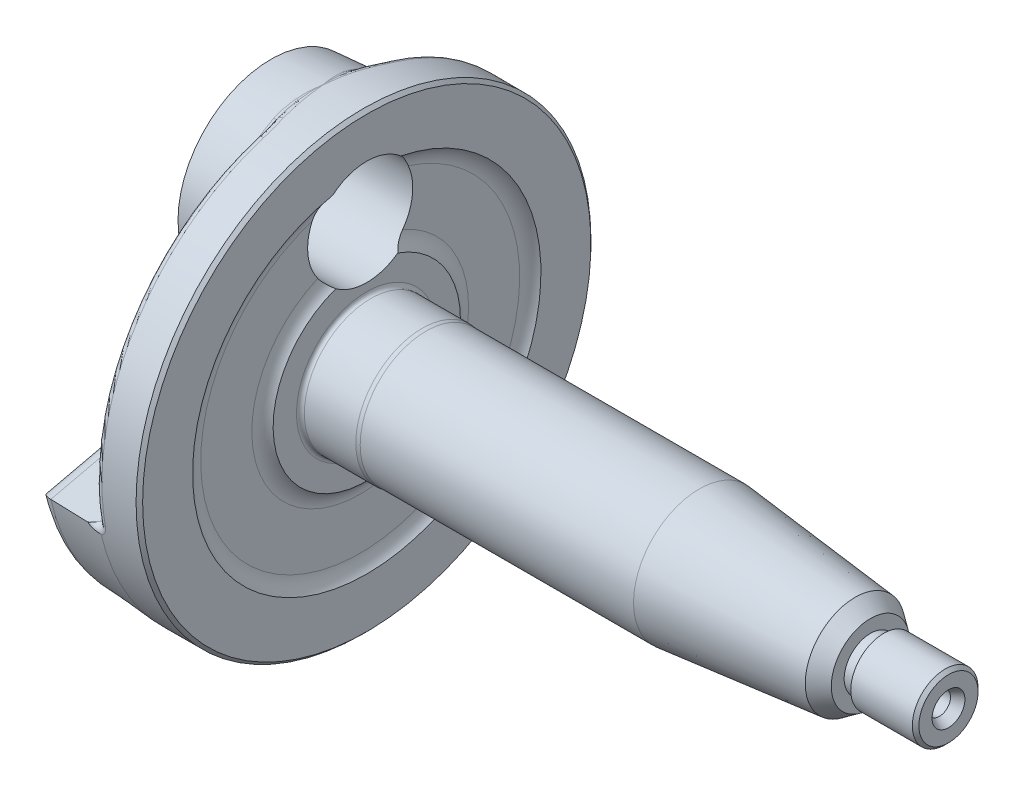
SolidWorks part; units mm, degrees
ref_plane "Plan de face" through (0, 0, 0) normal (0, 0, 1) x (1, 0, 0)
ref_plane "Plan de dessus" through (0, 0, 0) normal (0, 1, 0) x (1, 0, 0)
ref_plane "Plan de droite" through (0, 0, 0) normal (1, 0, 0) x (0, 0, -1)
sketch "Esquisse1" plane through (0, 0, 0) normal (0, 0, 1) x (1, 0, 0)
  line L0 (0, 0) -> (105.7, 0) construction
  line L1 (10.5, 34.6) -> (0, 33.8658)
  line L2 (10.5, 34.6) -> (17.2, 34.6)
  line L3 (17.2, 34.6) -> (17.2, 10.1)
  line L4 (67.7816, 10) -> (26.2, 10)
  line L5 (67.7816, 10) -> (91.5, 7.5908)
  line L6 (91.5, 7.5908) -> (95.2, 5)
  line L7 (95.2, 5) -> (105.7, 5)
  line L8 (105.7, 5) -> (105.7, 0)
  line L9 (0, 0) -> (105.7, 0)
  line L10 (0, 33.8658) -> (0, 0)
  line L11 (26.2, 10) -> (25.6329, 10.1)
  line L12 (25.6329, 10.1) -> (17.2, 10.1)
  line L13 (105.7, 0) -> (145.9071, 0) construction
  dimension "D1" = 69.2
  dimension "D2" = 9
  dimension "D3" = 10
  dimension "D4" = 35
  dimension "D5" = 88.5
  dimension "D6" = 74.3
  dimension "D7" = 10.5
  dimension "D8" = 6.7
  dimension "D9" = 5.8
  dimension "D10" = 4
  dimension "D11" = 17.2
  dimension "D12" = 10
  dimension "D13" = 20
  dimension "D14" = 20.2
revolve "Révolution1" add sketch "Esquisse1" angle 360 about L0
sketch "Esquisse2" plane through (0, 0, 0) normal (-1, 0, 0) x (0, 0, 1)
  line L0 (0, 0) -> (-49.8629, 0) construction
  line L1 (-46.6363, 10.7668) -> (-6.8206, 1.5747)
  line L2 (6.8206, -1.5747) -> (41.2588, -9.5253)
  line L3 (41.2588, -9.5253) -> (41.2588, 38.0793)
  line L4 (41.2588, 38.0793) -> (-46.6363, 38.0793)
  line L5 (-46.6363, 38.0793) -> (-46.6363, 10.7668)
  arc A0 (-6.8206, 1.5747) -> (6.8206, -1.5747) centre (0, 0) ccw
  dimension "D1" = 14
  dimension "D2" = 13
extrude "Extrusion1" cut sketch "Esquisse2" against normal blind 10.5 draft 4
sketch "Esquisse3" plane through (10.5, 0, 0) normal (-1, 0, 0) x (0, 0, 1)
  line L0 (0, 0) -> (0, 26.2707) construction
  line L2 (-10, -10.595) -> (10, -10.595)
  line L3 (-10, -10.595) -> (-10, 23.8355)
  line L4 (-10, 23.8355) -> (10, 23.8355)
  line L5 (10, -10.595) -> (10, 23.8355)
  dimension "D1" = 10
  dimension "D2" = 10
extrude "Extrusion2" add sketch "Esquisse3" along normal blind 4.65 draft 4
sketch "Esquisse4" plane through (10.5, 0, 0) normal (-1, 0, 0) x (0, 0, 1)
  circle A0 centre (0, 19.9) radius 14.7
  circle A1 centre (0, 0) radius 34.6 construction
  dimension "D1" = 19.9
extrude "Extrusion3" add sketch "Esquisse4" along normal blind 7.87 draft 4
sketch "Esquisse5" plane through (2.63, 0, 0) normal (-1, 0, 0) x (0, 0, 1)
  circle A0 centre (0, 19.9) radius 8
  circle A1 centre (0, 19.9) radius 14.1497 construction
  dimension "D1" = 16
extrude "Extrusion4" cut sketch "Esquisse5" against normal through all
hole_wizard "Dégagement M31" positions "Esquisse3D1" profile "Esquisse6" hole size "M3" standard "ISO"
sketch3d "Esquisse3D1"
  line L0 (105.7, 0, 0) -> (95.2, 0, 0) construction
  line L1 (0, 0, 0) -> (5.85, 0, 0) construction
  point P0 (0, 0, 0)
  point P3 (105.7, 0, 0)
  point P8 (5.85, 0, 0)
sketch "Esquisse6" plane through (105.7, 0, 0) normal (0, 1, 0) x (0, 0, -1)
  line L0 (0, 0) -> (0, 6.0215)
  line L1 (0, 6.0215) -> (1.7, 5)
  line L2 (1.7, 5) -> (1.7, 1.3856)
  line L3 (1.7, 1.3856) -> (2.5, 0)
  line L5 (2.5, 0) -> (0, 0)
  line L6 (-1.7, 1.3856) -> (-2.5, 0) construction
  line L10 (0, 6.0215) -> (-1.7, 5) construction
  line L11 (0, -6.35) -> (0, 107.95) construction
  dimension "Diamètre du perçage" = 3.4
  dimension "Profondeur du perçage" = 5
  dimension "Diamètre du fraisage entrant" = 5
  dimension "Angle du fraisage entrant" = 60
  dimension "Angle de pointe" = 118
sketch "Esquisse7" plane through (0, 0, 0) normal (0, 0, 1) x (1, 0, 0)
  line L0 (0, 0) -> (111.528, 0) construction
  line L1 (17.2, 14.25) -> (17.2, 26.5)
  line L2 (17.2, -34.6) -> (17.2, 34.6) construction
  line L3 (16.2, 24.2639) -> (16.2, 16.4861)
  line L6 (0, 7.6181) -> (0, -33.8658) construction
  arc A0 (17.2, 26.5) -> (16.2, 24.2639) centre (19.2, 24.2639) ccw
  arc A1 (16.2, 16.4861) -> (17.2, 14.25) centre (19.2, 16.4861) ccw
  dimension "D1" = 16.2
  dimension "D2" = 3
  dimension "D5" = 3
  dimension "D3" = 28.5
  dimension "D4" = 53
revolve "Enlèvement de matière-Révolution1" cut sketch "Esquisse7" angle 360 about L0
ref_plane "Plan1" through (91.2, 0, 0) normal (1, 0, 0) x (0, 0, -1)
sketch "Esquisse8" plane through (91.2, 0, 0) normal (1, 0, 0) x (0, 0, -1)
  line L0 (0, 0) -> (0, 19.9) construction
  line L1 (0, 0) -> (18.2189, 2.5605) construction
  line L2 (5.552, 15.0374) -> (9.4383, -12.6147)
  line L3 (9.4383, -12.6147) -> (16.7149, -11.5921)
  line L4 (16.7149, -11.5921) -> (12.8286, 16.06)
  line L5 (12.8286, 16.06) -> (5.552, 15.0374)
  circle A2 centre (0, 0) radius 7.5908 construction
  dimension "D1" = 82
extrude "Extrusion5" cut sketch "Esquisse8" against normal blind 5.6 and the other way through all
hole_wizard "Dégagement M32" positions "Esquisse3D2" profile "Esquisse10" hole size "M3" standard "ISO"
sketch3d "Esquisse3D2"
  line L0 (85.6, 4.1018, -7.0889) -> (85.6, -1.9889, -7.9449) construction
  point P0 (88.1, 0.9501, -7.5318)
  dimension "D1" = 2.5
sketch "Esquisse10" plane through (88.1, 0.9501, -7.5318) normal (1, 0, 0) x (0, 0.9903, 0.1392)
  line L0 (0, 0) -> (0, 6.7215)
  line L1 (0, 6.7215) -> (1.7, 5.7)
  line L2 (1.7, 5.7) -> (1.7, 0.3464)
  line L3 (1.7, 0.3464) -> (1.9, 0)
  line L5 (1.9, 0) -> (0, 0)
  line L6 (-1.7, 0.3464) -> (-1.9, 0) construction
  line L10 (0, 6.7215) -> (-1.7, 5.7) construction
  line L11 (0, -6.35) -> (0, 107.95) construction
  dimension "Diamètre du perçage" = 3.4
  dimension "Profondeur du perçage" = 5.7
  dimension "Diamètre du fraisage entrant" = 3.8
  dimension "Angle du fraisage entrant" = 60
  dimension "Angle de pointe" = 118
fillet "Congé1" radius 2.5 4 edges at (0, -6.8206, -1.5747) (0, -4.5964, 19.9092) (0, 4.5964, -19.9092) (0, -32.9978, -7.6181)
fillet "Congé2" radius 4 2 edges at (5.85, 5.9609, -9.6748) (5.85, 3.7272, 9.6748)
fillet "Congé3" radius 0.6 1 edges at (17.2, 0, 10.1)
fillet "Congé4" radius 2 1 edges at (95.2, 0, 5)
fillet "Congé5" radius 1 6 edges at (10.5, 25.2714, 13.6835) (10.5, 3.7852, 10) (10.5, -4.3106, 21.9354) (10.5, 5.7796, -21.7702) (10.5, 6.0939, -10) (10.5, 25.2714, -13.6835)
chamfer "Chanfrein1" distance 0.4 angle 60 1 edges at (2.63, 19.9, 8)
chamfer "Chanfrein2" distance 0.5 angle 45 2 edges at (105.7, 0, 5) (17.2, 0, 34.6)
fillet "Congé6" radius 1 5 edges at (10.1442, 9.0526, -10.1676) (7.5612, 8.7203, -9.2252) (5.85, 5.5252, 0) (6.9036, 8.3269, 8.6501) (10.1442, 9.0526, 10.1676)
fillet "Congé8" radius 1 5 edges at (7.0541, 2.5391, -8.8053) (7.1208, -1.5366, 8.8691) (10.2314, 3.3773, -10.2506) (10.2314, -1.3558, 10.2506) (5.85, -6.5909, 0)
fillet "Congé9" radius 1 8 edges at (5.8035, -0.3086, 5.9518) (1.083, -1.8993, 7.0192) (1.083, 1.3699, -7.1414) (5.6473, 2.1131, -5.8947)
fillet "Congé10" radius 1 4 edges at (10.5, 25.3312, -23.5688) (10.5, 34.4219, -3.5064) (10.5, 34.4219, 3.5064) (10.5, 19.3802, 28.663)
sketch "Esquisse11" plane through (0, 0, 0) normal (0, 1, 0) x (1, 0, 0)
  line L0 (95.8306, 7) -> (95.8306, 4)
  line L1 (95.8306, -5) -> (95.8306, 5) construction
  line L2 (95.8306, 4) -> (93.8306, 4)
  line L4 (93.8306, 4) -> (93.8306, 7)
  line L5 (93.8306, 7) -> (95.8306, 7)
  line L6 (107.8486, 0) -> (81.2302, 0) construction
  dimension "D1" = 3
  dimension "D2" = 2
  dimension "D3" = 4
revolve "Enlèvement de matière-Révolution2" cut sketch "Esquisse11" angle 360 about L6
sketch "Esquisse12" plane through (0, 0, 0) normal (0, 1, 0) x (1, 0, 0)
  line L0 (6.815, -3.5527) -> (6.815, 3.185) construction
  line L1 (5.85, 5.9448) -> (5.85, -5.9448) construction
  line L2 (104.735, 2.7379) -> (104.735, -3.4151) construction
  line L4 (105.7, -4.5) -> (105.7, 4.5) construction
  dimension "D1" = 0.965
  dimension "D2" = 0.965
